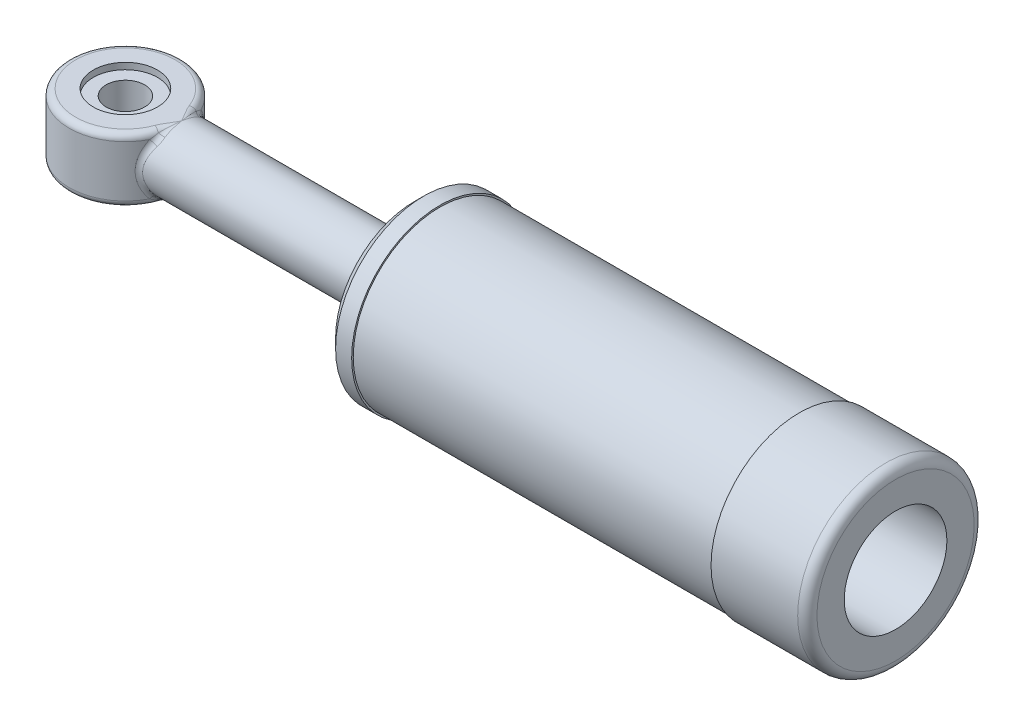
SolidWorks part; units mm, degrees
ref_plane "Face" through (0, 0, 0) normal (0, 0, 1) x (1, 0, 0)
ref_plane "Dessus" through (0, 0, 0) normal (0, 1, 0) x (1, 0, 0)
ref_plane "Droite" through (0, 0, 0) normal (1, 0, 0) x (0, 0, -1)
sketch "Esquisse1" plane through (0, 0, 0) normal (0, 0, 1) x (1, 0, 0)
  line L0 (0, 0) -> (252.5641, 0) construction
  line L1 (0, 0) -> (0, 10)
  line L2 (0, 10) -> (90, 10)
  line L3 (90, 10) -> (90, 24.5)
  line L4 (90, 24.5) -> (93, 27.5)
  line L5 (93, 27.5) -> (240, 27.5) construction
  line L6 (240, 27.5) -> (240, 0)
  line L7 (0, 0) -> (240, 0)
  line L11 (210, 27.5) -> (240, 27.5)
  line L13 (210, 27.5) -> (210, 27)
  line L14 (210, 27) -> (98, 27)
  line L15 (98, 27) -> (98, 27.5)
  line L16 (98, 27.5) -> (93, 27.5)
  dimension "D1" = 20
  dimension "D2" = 27.5
  dimension "D3" = 3
  dimension "D4" = 45
  dimension "D5" = 90
  dimension "D6" = 150
  dimension "D7" = 30
  dimension "D8" = 1
  dimension "D9" = 112
revolve "Révolution1" add sketch "Esquisse1" angle 360 about L0
sketch "Esquisse2" plane through (0, 0, 0) normal (0, 1, 0) x (1, 0, 0)
  circle A0 centre (0, 0) radius 17.5
  dimension "D1" = 35
extrude "Extrusion1" add sketch "Esquisse2" along normal mid plane 20
sketch "Esquisse3" plane through (240, 0, 0) normal (1, 0, 0) x (0, 0, -1)
  circle A0 centre (0, 0) radius 16
  dimension "D1" = 32
extrude "Enlèv. mat.-Extru.1" cut sketch "Esquisse3" against normal blind 100
fillet "Congé1" radius 3 2 edges at (90, 0, 10) (240, 0, 27.5)
fillet "Congé2" radius 2 2 edges at (0, -10, 17.5) (0, 10, 17.5)
fillet "Congé3" radius 2 6 edges at (17.208, -9.4798, 3.1833) (17.1811, 9.4308, -3.3258) (14.3628, -0.203, -9.9979) (17.2306, -9.5207, -3.0589) (14.3628, -0.203, -9.9979) (17.2613, 9.5762, 2.8803)
sketch "Esquisse4" plane through (0, -10, 0) normal (0, -1, 0) x (1, 0, 0)
  circle A0 centre (0, 0) radius 6
  dimension "D1" = 12
extrude "Enlèv. mat.-Extru.2" cut sketch "Esquisse4" against normal through all
sketch "Esquisse5" plane through (0, -10, 0) normal (0, -1, 0) x (1, 0, 0)
  circle A0 centre (0, 0) radius 10
  dimension "D1" = 20
extrude "Enlèv. mat.-Extru.3" cut sketch "Esquisse5" against normal blind 2
sketch "Esquisse6" plane through (0, 10, 0) normal (0, 1, 0) x (-1, 0, 0)
  circle A0 centre (0, 0) radius 10
  dimension "D1" = 20
extrude "Enlèv. mat.-Extru.4" cut sketch "Esquisse6" against normal blind 2
